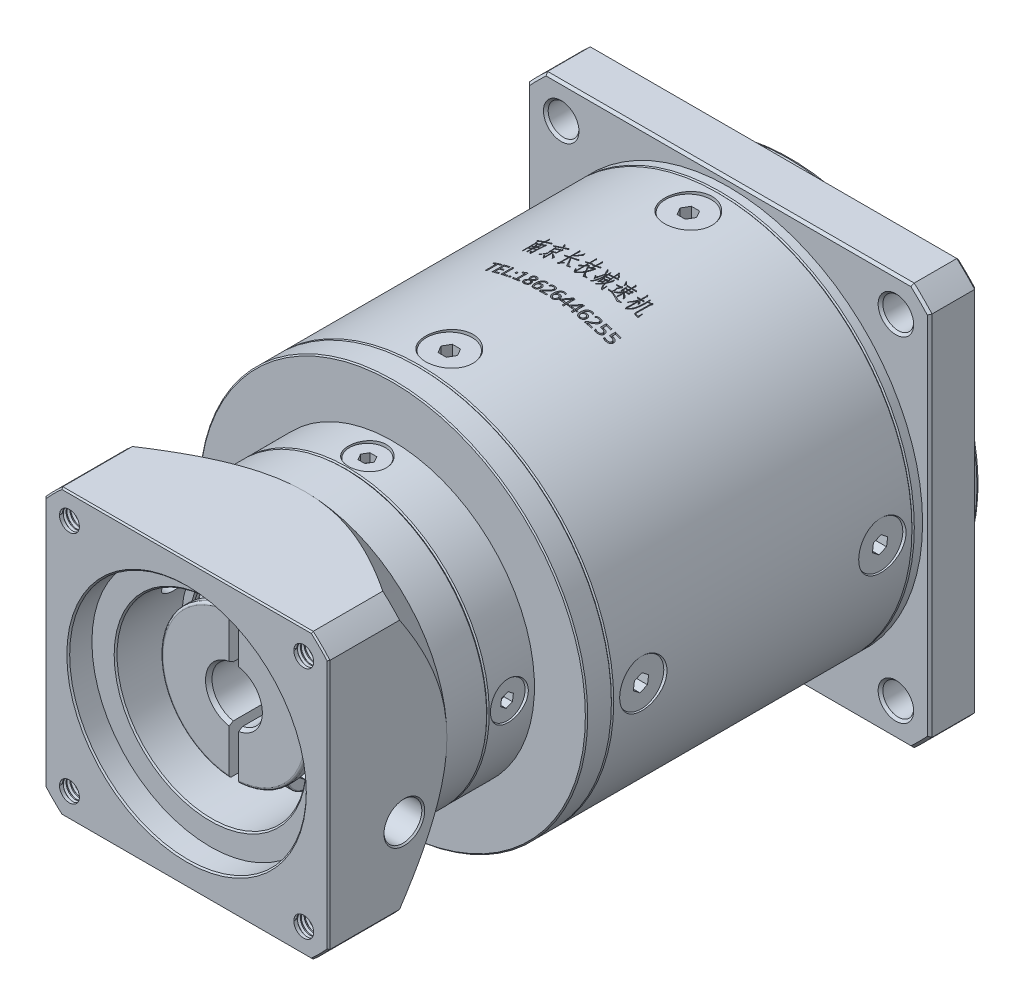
SolidWorks part; units mm, degrees
ref_plane "前视基准面" through (0, 0, 0) normal (0, 0, 1) x (1, 0, 0)
ref_plane "上视基准面" through (0, 0, 0) normal (0, 1, 0) x (1, 0, 0)
ref_plane "右视基准面" through (0, 0, 0) normal (1, 0, 0) x (0, 0, -1)
imported_body "11-50-70-M5-1-solid1"
imported_body "11-50-70-M5-1-solid2"
imported_body "11-50-70-M5-1-solid3"
imported_body "11-50-70-M5-1-solid4"
imported_body "11-50-70-M5-1-solid5"
imported_body "ZF80-K15-L3-F60-5-solid1"
imported_body "ZF80-K15-L3-F60-5-solid2"
imported_body "ZF80-K15-L3-F60-5-solid3"
imported_body "ZF80-K15-L3-F60-5-solid4"
imported_body "ZF80-K15-L3-F60-5-solid5"
imported_body "ZF80-K15-L3-F60-5-solid6"
imported_body "ZF80-K15-L3-F60-5-solid7"
imported_body "ZF80-K15-L3-F60-5-solid8"
imported_body "ZF80-K15-L3-F60-5-solid9"
imported_body "ZF80-K15-L3-F60-5-solid10"
imported_body "ZF80-K15-L3-F60-5-solid11"
imported_body "ZF80-K15-L3-F60-5-solid12"
imported_body "ZF80-K15-L3-F60-5-solid13"
sketch "草图1" plane through (0, 0, -79.3936) normal (0, 0, -1) x (-1, 0, 0)
  circle A0 centre (63.8706, 20.5839) radius 10.9973
  dimension "D1" = 21.9945
extrude "凸台-拉伸1" add sketch "草图1" along normal blind 5
